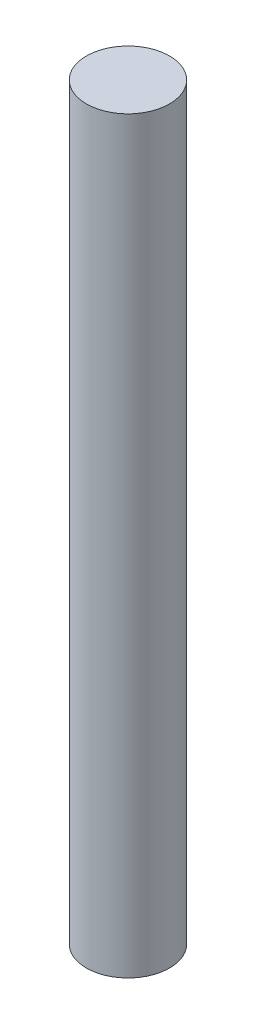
SolidWorks part; units mm, degrees
ref_plane "Front Plane" through (0, 0, 0) normal (0, 0, 1) x (1, 0, 0)
ref_plane "Top Plane" through (0, 0, 0) normal (0, 1, 0) x (1, 0, 0)
ref_plane "Right Plane" through (0, 0, 0) normal (1, 0, 0) x (0, 0, -1)
sketch "Sketch1" plane through (0, 0, 0) normal (0, 1, 0) x (1, 0, 0)
  circle A0 centre (0, 0) radius 24.257
extrude "Extrude1" add sketch "Sketch1" along normal blind 436.88
